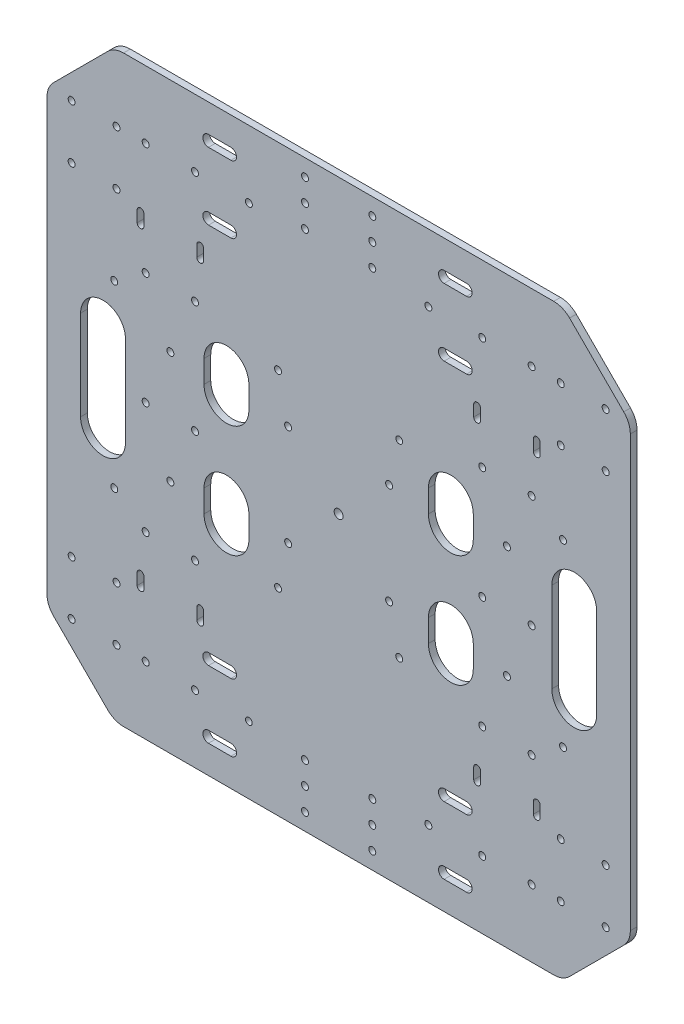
SolidWorks part; units mm, degrees
ref_plane "前视基准面" through (0, 0, 0) normal (0, 0, 1) x (1, 0, 0)
ref_plane "上视基准面" through (0, 0, 0) normal (0, 1, 0) x (1, 0, 0)
ref_plane "右视基准面" through (0, 0, 0) normal (1, 0, 0) x (0, 0, -1)
other "Configuration Table"
sketch "草图1" plane through (0, 0, 0) normal (0, 0, 1) x (1, 0, 0)
  line L1 (-130, 130) -> (130, 130) construction
  line L2 (-130, 130) -> (-130, -130) construction
  line L3 (-130, -130) -> (130, -130) construction
  line L4 (130, 130) -> (130, -130) construction
  line L5 (-130, 130) -> (130, -130) construction
  line L6 (-130, -130) -> (130, 130) construction
  line L8 (-130, 100) -> (-100, 130)
  line L9 (-100, 130) -> (100, 130)
  line L10 (100, 130) -> (130, 100)
  line L11 (130, 100) -> (130, -100)
  line L12 (130, -100) -> (100, -130)
  line L13 (100, -130) -> (-100, -130)
  line L14 (-100, -130) -> (-130, -100)
  line L15 (-130, -100) -> (-130, 100)
  circle A0 centre (0, 0) radius 2
  point P0 (0, 0)
extrude "凸台-拉伸1" add sketch "草图1" along normal blind 3
sketch "草图2" plane through (0, 0, 0) normal (0, 0, -1) x (-1, 0, 0)
  line L1 (-75, 100) -> (75, 100) construction
  line L2 (-75, 100) -> (-75, -100) construction
  line L3 (-75, -100) -> (75, -100) construction
  line L4 (75, 100) -> (75, -100) construction
  line L5 (-75, 100) -> (75, -100) construction
  line L6 (-75, -100) -> (75, 100) construction
  point P0 (0, 0)
sketch "草图3" plane through (0, 0, 3) normal (0, 0, 1) x (1, 0, 0)
  line L0 (-86, 100) -> (-64, 100) construction
  line L1 (75, 100) -> (-75, 100) construction
  line L2 (86, 100) -> (64, 100) construction
  line L3 (-86, -100) -> (-64, -100) construction
  line L4 (75, -100) -> (-75, -100) construction
  line L5 (64, -100) -> (86, -100) construction
  line L6 (-75, 100) -> (-75, -100) construction
  line L7 (75, 100) -> (75, -100) construction
  line L8 (-40, 100) -> (40, 100) construction
  line L9 (-100, -100) -> (100, -100) construction
  line L10 (-100, -100) -> (-100, 100) construction
  line L11 (-100, 100) -> (100, 100) construction
  line L12 (100, -100) -> (100, 100) construction
  line L13 (-100, -100) -> (100, 100) construction
  line L14 (-100, 100) -> (100, -100) construction
  line L15 (-100, 40) -> (-100, -40) construction
  line L16 (100, 40) -> (100, -40) construction
  line L17 (-40, -100) -> (40, -100) construction
  line L18 (0, 115) -> (0, 85) construction
  line L19 (-90, 85) -> (90, 85) construction
  line L20 (0, -100) -> (0, -85) construction
  line L21 (-75, 100) -> (-75, 25) construction
  line L22 (-75, -100) -> (-75, -25) construction
  circle A0 centre (-86, 100) radius 1.55
  circle A1 centre (-64, 100) radius 1.55
  circle A2 centre (64, 100) radius 1.55
  circle A3 centre (86, 100) radius 1.55
  circle A5 centre (-86, -100) radius 1.55
  circle A6 centre (-64, -100) radius 1.55
  circle A7 centre (64, -100) radius 1.55
  circle A8 centre (86, -100) radius 1.55
  circle A11 centre (-40, 100) radius 1.55
  circle A12 centre (40, 100) radius 1.55
  circle A13 centre (100, 40) radius 1.55
  circle A14 centre (100, -40) radius 1.55
  circle A15 centre (40, -100) radius 1.55
  circle A16 centre (-40, -100) radius 1.5
  circle A17 centre (-100, -40) radius 1.55
  circle A18 centre (-100, 40) radius 1.55
  circle A19 centre (-90, 85) radius 1.55 construction
  circle A20 centre (90, 85) radius 1.55 construction
  circle A21 centre (-90, -85) radius 1.55 construction
  circle A22 centre (90, -85) radius 1.55 construction
  circle A23 centre (-86, 50) radius 1.55
  circle A24 centre (-64, 50) radius 1.55
  circle A25 centre (-86, -50) radius 1.55
  circle A26 centre (-64, -50) radius 1.55
  circle A27 centre (-86, 0) radius 1.55
  circle A28 centre (-64, 0) radius 1.55
  circle A29 centre (64, 50) radius 1.55
  circle A30 centre (86, 50) radius 1.55
  circle A31 centre (64, 0) radius 1.55
  circle A32 centre (86, 0) radius 1.55
  circle A33 centre (64, -50) radius 1.55
  circle A34 centre (86, -50) radius 1.55
  circle A35 centre (-75, 25) radius 1.55
  circle A36 centre (-75, -25) radius 1.55
  circle A38 centre (75, -25) radius 1.55
  circle A39 centre (75, 25) radius 1.55
  point P6 (-75, 100)
  point P13 (75, 100)
  point P23 (-75, -100)
  point P30 (75, -100)
  point P36 (0, 0)
  point P45 (0, 100)
  point P48 (-100, 0)
  point P51 (100, 0)
  point P54 (0, -100)
  point P66 (0, 100)
  point P68 (0, 85)
extrude "机架安装孔" cut sketch "草图3" against normal through all
sketch "草图5" plane through (0, 0, 3) normal (0, 0, 1) x (1, 0, 0)
  line L6 (-22.5, 22.5) -> (22.5, 22.5) construction
  line L7 (-22.5, 22.5) -> (-22.5, -22.5) construction
  line L8 (-22.5, -22.5) -> (22.5, -22.5) construction
  line L9 (22.5, 22.5) -> (22.5, -22.5) construction
  line L10 (-22.5, 22.5) -> (22.5, -22.5) construction
  line L11 (-22.5, -22.5) -> (22.5, 22.5) construction
  line L12 (-27, 42) -> (27, 42) construction
  line L13 (-27, 42) -> (-27, -42) construction
  line L14 (-27, -42) -> (27, -42) construction
  line L15 (27, 42) -> (27, -42) construction
  line L16 (-27, 42) -> (27, -42) construction
  line L17 (-27, -42) -> (27, 42) construction
  circle A0 centre (-22.5, 22.5) radius 1.55
  circle A1 centre (22.5, 22.5) radius 1.55
  circle A2 centre (-22.5, -22.5) radius 1.55
  circle A3 centre (22.5, -22.5) radius 1.55
  circle A4 centre (-27, 42) radius 1.55
  circle A5 centre (27, 42) radius 1.5
  circle A6 centre (27, -42) radius 1.55
  circle A7 centre (-27, -42) radius 1.55
  point P0 (0, 0)
  point P10 (0, 0)
extrude "飞控及电脑孔" cut sketch "草图5" against normal through all contours A4 | A0 | A5 | A1 | A2 | A3 | A6 | A7
sketch "草图6" plane through (0, 0, 3) normal (0, 0, 1) x (1, 0, 0)
  line L0 (-15, -122.5) -> (15, -122.5) construction
  line L3 (100, 130) -> (-100, 130) construction
  line L4 (-15, 122.5) -> (15, 122.5) construction
  line L5 (0, 122.5) -> (0, 112.5) construction
  line L6 (-15, 112.5) -> (15, 112.5) construction
  line L7 (-100, -130) -> (100, -130) construction
  line L8 (-15, -112.5) -> (15, -112.5) construction
  line L9 (-15, 102.5) -> (15, 102.5) construction
  line L10 (-15, -102.5) -> (15, -102.5) construction
  circle A0 centre (-15, 122.5) radius 1.55
  circle A1 centre (15, 122.5) radius 1.55
  circle A2 centre (-15, 112.5) radius 1.55
  circle A3 centre (15, 112.5) radius 1.55
  circle A4 centre (-15, -112.5) radius 1.55
  circle A5 centre (15, -112.5) radius 1.55
  circle A6 centre (-15, -122.5) radius 1.55
  circle A7 centre (15, -122.5) radius 1.55
  circle A8 centre (-15, 102.5) radius 1.55
  circle A9 centre (15, 102.5) radius 1.55
  circle A10 centre (-15, -102.5) radius 1.55
  circle A11 centre (15, -102.5) radius 1.55
  point P10 (0, 122.5)
  point P16 (0, 112.5)
  point P22 (0, -122.5)
  point P25 (0, -112.5)
  point P33 (0, 102.5)
  point P35 (0, 92.5)
  dimension "D1" = 7.5
  dimension "D2" = 10
  dimension "D4" = 7.5
  dimension "D5" = 10
  dimension "D3" = 2
  dimension "D6" = 2
extrude "扩展孔位" cut sketch "草图6" against normal through all contours A0 | A1 | A2 | A3 | A4 | A5 | A6 | A7 | A8 | A9 | A10 | A11
sketch "草图8" plane through (0, 0, 3) normal (0, 0, 1) x (1, 0, 0)
  line L0 (-50, 20) -> (-50, 30) construction
  line L1 (-60, 20) -> (-60, 30)
  line L2 (-40, 20) -> (-40, 30)
  line L3 (50, 20) -> (50, 30) construction
  line L4 (40, 20) -> (40, 30)
  line L5 (60, 20) -> (60, 30)
  line L6 (50, -30) -> (50, -20) construction
  line L7 (40, -30) -> (40, -20)
  line L8 (60, -30) -> (60, -20)
  line L9 (-50, -30) -> (-50, -20) construction
  line L10 (-60, -30) -> (-60, -20)
  line L11 (-40, -30) -> (-40, -20)
  line L12 (-105, 20) -> (-105, -20) construction
  line L15 (-95, 20) -> (-95, -20)
  line L20 (-115, 20) -> (-115, -20)
  line L23 (0, 100) -> (0, -100)
  line L26 (75, 100) -> (-75, 100) construction
  line L27 (75, -100) -> (-75, -100) construction
  line L28 (105, 20) -> (105, -20) construction
  line L29 (95, 20) -> (95, -20)
  line L30 (115, 20) -> (115, -20)
  arc A0 (-60, 20) -> (-40, 20) centre (-50, 20) ccw
  arc A1 (-40, 30) -> (-60, 30) centre (-50, 30) ccw
  arc A2 (40, 20) -> (60, 20) centre (50, 20) ccw
  arc A3 (60, 30) -> (40, 30) centre (50, 30) ccw
  arc A4 (40, -30) -> (60, -30) centre (50, -30) ccw
  arc A5 (60, -20) -> (40, -20) centre (50, -20) ccw
  arc A6 (-60, -30) -> (-40, -30) centre (-50, -30) ccw
  arc A7 (-40, -20) -> (-60, -20) centre (-50, -20) ccw
  arc A18 (-95, 20) -> (-115, 20) centre (-105, 20) ccw
  arc A19 (-115, -20) -> (-95, -20) centre (-105, -20) ccw
  arc A20 (95, 20) -> (115, 20) centre (105, 20) cw
  arc A21 (115, -20) -> (95, -20) centre (105, -20) cw
  point P2 (-50, 25)
  point P11 (50, 25)
  point P18 (50, -25)
  point P25 (-50, -25)
  point P30 (-105, 0)
  point P43 (105, 0)
  dimension "D1" = 20
  dimension "D2" = 10
  dimension "D3" = 2
  dimension "D4" = 2
extrude "减重孔" cut sketch "草图8" against normal through all
sketch "草图9" [suppressed] plane through (0, 0, 3) normal (0, 0, 1) x (1, 0, 0)
  line L0 (-130, 100) -> (-130, -100) construction
  line L3 (130, -100) -> (130, 100) construction
  line L4 (-120, 12) -> (-100, 12) construction
  line L5 (-120, 12) -> (-120, -12) construction
  line L6 (-120, -12) -> (-100, -12) construction
  line L7 (-100, 12) -> (-100, -12) construction
  line L8 (-120, 12) -> (-100, -12) construction
  line L9 (-120, -12) -> (-100, 12) construction
  line L10 (120, 12) -> (100, 12) construction
  line L11 (120, 12) -> (120, -12) construction
  line L12 (120, -12) -> (100, -12) construction
  line L13 (100, 12) -> (100, -12) construction
  line L14 (120, 12) -> (100, -12) construction
  line L15 (120, -12) -> (100, 12) construction
  circle A0 centre (-120, 12) radius 1.55
  circle A1 centre (-100, 12) radius 1.55
  circle A2 centre (-100, -12) radius 1.55
  circle A3 centre (-120, -12) radius 1.55
  circle A4 centre (100, 12) radius 1.55
  circle A5 centre (120, 12) radius 1.55
  circle A6 centre (120, -12) radius 1.55
  circle A7 centre (100, -12) radius 1.55
  point P2 (110, 0)
  point P6 (-110, 0)
  dimension "D1" = 20
  dimension "D2" = 20
fillet "圆角1" radius 10 8 edges at (-130, -100, 1.5) (-100, -130, 1.5) (100, -130, 1.5) (130, -100, 1.5) (130, 100, 1.5) (100, 130, 1.5) (-100, 130, 1.5) (-130, 100, 1.5)
sketch "草图10" plane through (0, 0, 0) normal (0, 0, -1) x (-1, 0, 0)
  line L0 (-86, 100) -> (-86, 50) construction
  line L15 (-96.5, 103) -> (-99, 103) construction
  line L16 (-130.1713, 103) -> (-96.5, 103) construction
  line L17 (-130.1713, 103) -> (-130.1713, 72.3897) construction
  line L18 (-130.1713, 72.3897) -> (-96.5, 72.3897) construction
  line L19 (-96.5, 103) -> (-96.5, 72.3897) construction
  line L20 (-130.1713, 103) -> (-96.5, 72.3897) construction
  line L21 (-130.1713, 72.3897) -> (-96.5, 103) construction
  line L22 (-99, 103) -> (-99, 72.3897) construction
  line L23 (-99, 100) -> (-99, 76) construction
  line L24 (-99, 76) -> (-119, 76) construction
  line L25 (-99, 100) -> (-119, 100) construction
  circle A0 centre (-119, 100) radius 1.55
  circle A1 centre (-119, 76) radius 1.55
  circle A2 centre (-99, 100) radius 1.55
  circle A3 centre (-99, 76) radius 1.55
  point P7 (-113.3356, 87.6949)
  point P18 (-99, 88)
extrude "切除-拉伸1" cut sketch "草图10" against normal through all contours A0 | A2 | A1 | A3
ref_plane "基准面1" through (0, 0, 0) normal (1, 0, 0) x (0, 0, -1)
mirror "镜向1" about plane through (0, 0, 0) normal (1, 0, 0) of "切除-拉伸1"
ref_plane "基准面2" through (0, 0, 0) normal (0, 1, 0) x (1, 0, 0)
mirror "镜向2" about plane through (0, 0, 0) normal (0, 1, 0) of "镜向1", "切除-拉伸1"
sketch "草图11" plane through (0, 0, 0) normal (0, 0, -1) x (-1, 0, 0)
  line L0 (-88.2916, 72.5) -> (-61.7084, 72.5) construction
  line L2 (-130, -95.8579) -> (-130, 95.8579) construction
  line L4 (-88.2916, 72.5) -> (-88.2916, 67.5) construction
  line L5 (-86.7916, 72.5) -> (-86.7916, 67.5)
  line L6 (-89.7916, 72.5) -> (-89.7916, 67.5)
  line L7 (-61.7084, 72.5) -> (-61.7084, 67.5) construction
  line L8 (-60.2084, 72.5) -> (-60.2084, 67.5)
  line L9 (-63.2084, 72.5) -> (-63.2084, 67.5)
  line L10 (0, 1.65) -> (0, -1.65) construction
  line L11 (88.2916, 72.5) -> (61.7084, 72.5) construction
  line L12 (61.7084, 72.5) -> (61.7084, 67.5) construction
  line L13 (60.2084, 72.5) -> (60.2084, 67.5)
  line L14 (63.2084, 72.5) -> (63.2084, 67.5)
  line L15 (88.2916, 72.5) -> (88.2916, 67.5) construction
  line L16 (86.7916, 72.5) -> (86.7916, 67.5)
  line L17 (89.7916, 72.5) -> (89.7916, 67.5)
  line L18 (1.65, 0) -> (-1.65, 0) construction
  line L19 (-88.2916, -72.5) -> (-88.2916, -67.5) construction
  line L20 (-86.7916, -72.5) -> (-86.7916, -67.5)
  line L21 (-89.7916, -72.5) -> (-89.7916, -67.5)
  line L22 (-61.7084, -72.5) -> (-61.7084, -67.5) construction
  line L23 (-60.2084, -72.5) -> (-60.2084, -67.5)
  line L24 (-63.2084, -72.5) -> (-63.2084, -67.5)
  line L25 (61.7084, -72.5) -> (61.7084, -67.5) construction
  line L26 (60.2084, -72.5) -> (60.2084, -67.5)
  line L27 (63.2084, -72.5) -> (63.2084, -67.5)
  line L28 (88.2916, -72.5) -> (88.2916, -67.5) construction
  line L29 (86.7916, -72.5) -> (86.7916, -67.5)
  line L30 (89.7916, -72.5) -> (89.7916, -67.5)
  line L31 (88.2916, -72.5) -> (61.7084, -72.5) construction
  line L32 (-88.2916, -72.5) -> (-61.7084, -72.5) construction
  arc A0 (-86.7916, 72.5) -> (-89.7916, 72.5) centre (-88.2916, 72.5) ccw
  arc A1 (-89.7916, 67.5) -> (-86.7916, 67.5) centre (-88.2916, 67.5) ccw
  arc A2 (-60.2084, 72.5) -> (-63.2084, 72.5) centre (-61.7084, 72.5) ccw
  arc A3 (-63.2084, 67.5) -> (-60.2084, 67.5) centre (-61.7084, 67.5) ccw
  arc A4 (60.2084, 72.5) -> (63.2084, 72.5) centre (61.7084, 72.5) cw
  arc A5 (63.2084, 67.5) -> (60.2084, 67.5) centre (61.7084, 67.5) cw
  arc A6 (86.7916, 72.5) -> (89.7916, 72.5) centre (88.2916, 72.5) cw
  arc A7 (89.7916, 67.5) -> (86.7916, 67.5) centre (88.2916, 67.5) cw
  arc A8 (-86.7916, -72.5) -> (-89.7916, -72.5) centre (-88.2916, -72.5) cw
  arc A9 (-89.7916, -67.5) -> (-86.7916, -67.5) centre (-88.2916, -67.5) cw
  arc A10 (-60.2084, -72.5) -> (-63.2084, -72.5) centre (-61.7084, -72.5) cw
  arc A11 (-63.2084, -67.5) -> (-60.2084, -67.5) centre (-61.7084, -67.5) cw
  arc A12 (60.2084, -72.5) -> (63.2084, -72.5) centre (61.7084, -72.5) ccw
  arc A13 (63.2084, -67.5) -> (60.2084, -67.5) centre (61.7084, -67.5) ccw
  arc A14 (86.7916, -72.5) -> (89.7916, -72.5) centre (88.2916, -72.5) ccw
  arc A15 (89.7916, -67.5) -> (86.7916, -67.5) centre (88.2916, -67.5) ccw
  point P3 (-75, 72.5)
  point P6 (-88.2916, 70)
  point P12 (-61.7084, 70)
  point P23 (61.7084, 70)
  point P29 (88.2916, 70)
  point P34 (75, 72.5)
  point P39 (-88.2916, -70)
  point P46 (-61.7084, -70)
  point P53 (61.7084, -70)
  point P60 (88.2916, -70)
  point P69 (75, -72.5)
  point P70 (-75, -72.5)
  dimension "D4" = 1.5
  dimension "D5" = 1.5
  dimension "D1" = 27.5
  dimension "D2" = 55
  dimension "D3" = 5
extrude "切除-拉伸2" cut sketch "草图11" against normal through all
sketch "草图12" plane through (0, 0, 0) normal (0, 0, -1) x (-1, 0, 0)
  line L0 (-57, 115) -> (-47, 115) construction
  line L7 (-57, 117.5) -> (-47, 117.5)
  line L8 (-57, 112.5) -> (-47, 112.5)
  line L11 (-75, 100) -> (75, 100) construction
  line L14 (-64, 100) -> (-40, 100) construction
  line L17 (48, 115) -> (58, 115) construction
  line L20 (48, 117.5) -> (58, 117.5)
  line L23 (48, 112.5) -> (58, 112.5)
  line L26 (48, 85) -> (58, 85) construction
  line L29 (48, 87.5) -> (58, 87.5)
  line L32 (48, 82.5) -> (58, 82.5)
  line L35 (-57, 85) -> (-47, 85) construction
  line L38 (-57, 87.5) -> (-47, 87.5)
  line L41 (-57, 82.5) -> (-47, 82.5)
  line L44 (-64, -100) -> (-40, -100) construction
  line L47 (-57, -85) -> (-47, -85) construction
  line L50 (-57, -82.5) -> (-47, -82.5)
  line L53 (-57, -87.5) -> (-47, -87.5)
  line L56 (48, -85) -> (58, -85) construction
  line L59 (48, -82.5) -> (58, -82.5)
  line L62 (48, -87.5) -> (58, -87.5)
  line L65 (48, -115) -> (58, -115) construction
  line L68 (48, -112.5) -> (58, -112.5)
  line L71 (48, -117.5) -> (58, -117.5)
  line L74 (-57, -115) -> (-47, -115) construction
  line L77 (-57, -112.5) -> (-47, -112.5)
  line L80 (-57, -117.5) -> (-47, -117.5)
  arc A66 (-57, 117.5) -> (-57, 112.5) centre (-57, 115) ccw
  arc A67 (-47, 112.5) -> (-47, 117.5) centre (-47, 115) ccw
  arc A68 (48, 117.5) -> (48, 112.5) centre (48, 115) ccw
  arc A69 (58, 112.5) -> (58, 117.5) centre (58, 115) ccw
  arc A70 (48, 87.5) -> (48, 82.5) centre (48, 85) ccw
  arc A71 (58, 82.5) -> (58, 87.5) centre (58, 85) ccw
  arc A72 (-57, 87.5) -> (-57, 82.5) centre (-57, 85) ccw
  arc A73 (-47, 82.5) -> (-47, 87.5) centre (-47, 85) ccw
  arc A74 (-57, -82.5) -> (-57, -87.5) centre (-57, -85) ccw
  arc A75 (-47, -87.5) -> (-47, -82.5) centre (-47, -85) ccw
  arc A76 (48, -82.5) -> (48, -87.5) centre (48, -85) ccw
  arc A77 (58, -87.5) -> (58, -82.5) centre (58, -85) ccw
  arc A78 (48, -112.5) -> (48, -117.5) centre (48, -115) ccw
  arc A79 (58, -117.5) -> (58, -112.5) centre (58, -115) ccw
  arc A80 (-57, -112.5) -> (-57, -117.5) centre (-57, -115) ccw
  arc A81 (-47, -117.5) -> (-47, -112.5) centre (-47, -115) ccw
  point P2 (-52, 115)
  point P19 (53, 115)
  point P26 (53, 85)
  point P33 (-52, 85)
  point P38 (-52, -85)
  point P47 (53, -85)
  point P54 (53, -115)
  point P61 (-52, -115)
  dimension "D2" = 12
  dimension "D1" = 15
extrude "切除-拉伸3" cut sketch "草图12" against normal through all
